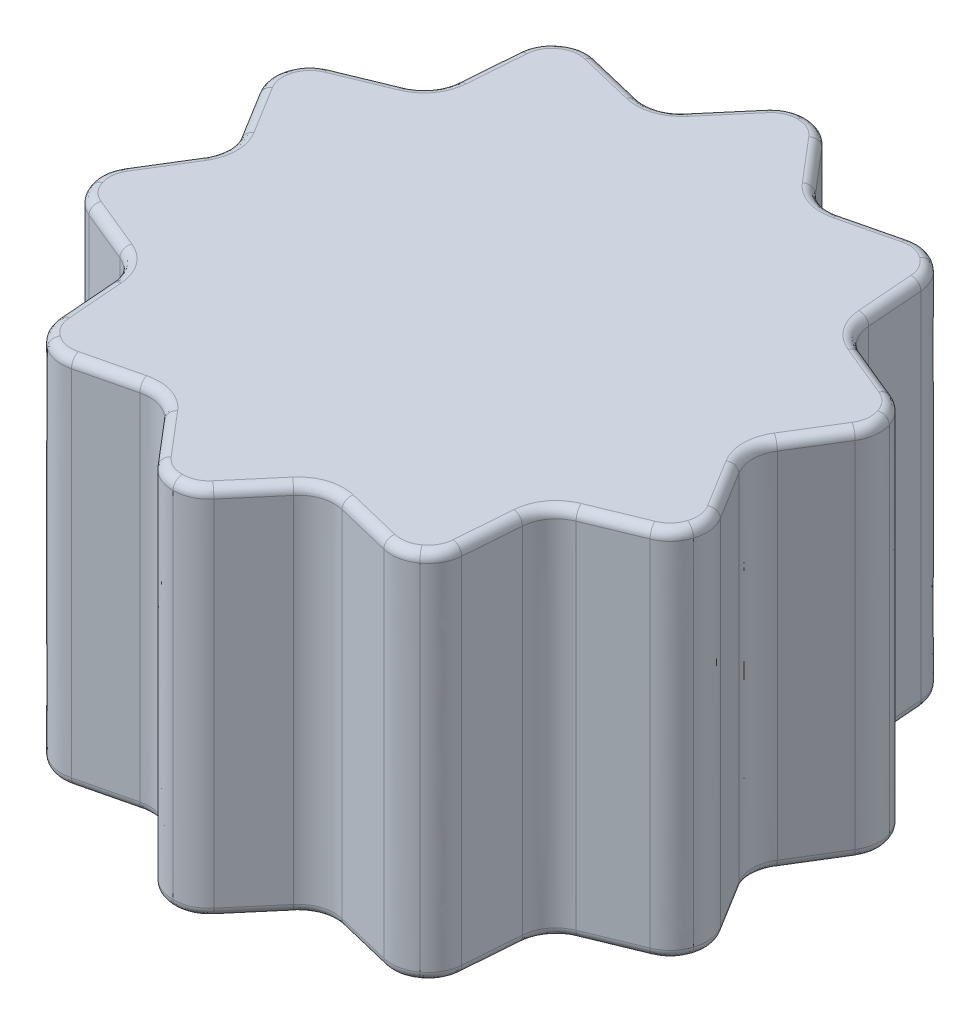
SolidWorks part; units mm, degrees
ref_plane "Front Plane" through (0, 0, 0) normal (0, 0, 1) x (1, 0, 0)
ref_plane "Top Plane" through (0, 0, 0) normal (0, 1, 0) x (1, 0, 0)
ref_plane "Right Plane" through (0, 0, 0) normal (1, 0, 0) x (0, 0, -1)
body saved out of another part "Stock-Wooden Clock Video-1"
fillet "Fillet1" radius 0.5 100 edges
